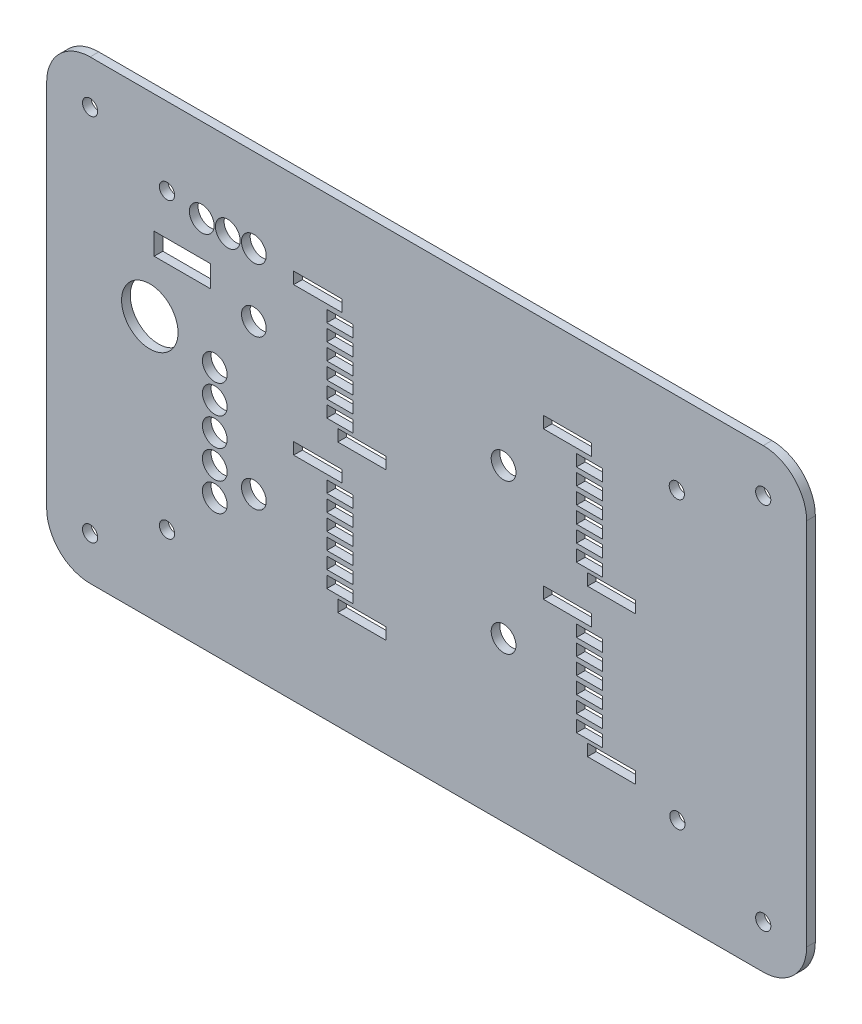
SolidWorks part; units mm, degrees
ref_plane "Face" through (0, 0, 0) normal (0, 0, 1) x (1, 0, 0)
ref_plane "Dessus" through (0, 0, 0) normal (0, 1, 0) x (1, 0, 0)
ref_plane "Droite" through (0, 0, 0) normal (1, 0, 0) x (0, 0, -1)
sketch "Esquisse1" plane through (0, 0, 0) normal (0, 0, 1) x (1, 0, 0)
  line L0 (-21.64, 5.85) -> (-10.56, 5.85)
  line L1 (-31.8, 29.45) -> (-20.72, 29.45)
  line L2 (46.94, -28.15) -> (46.94, -30.85)
  line L3 (46.94, 5.85) -> (46.94, 3.15)
  line L4 (35.86, 5.85) -> (46.94, 5.85)
  line L5 (35.86, 5.85) -> (35.86, 3.15)
  line L6 (-21.64, 3.15) -> (-10.56, 3.15)
  line L7 (-10.56, 5.85) -> (-10.56, 3.15)
  line L8 (-21.64, 5.85) -> (-21.64, 3.15)
  line L9 (35.86, 3.15) -> (46.94, 3.15)
  line L10 (-24.18, 9.35) -> (-18.18, 9.35)
  line L11 (-24.18, 9.35) -> (-24.18, 6.65)
  line L12 (-24.18, 6.65) -> (-18.18, 6.65)
  line L13 (-18.18, 9.35) -> (-18.18, 6.65)
  line L14 (-24.18, 13.15) -> (-18.18, 13.15)
  line L15 (-24.18, 13.15) -> (-24.18, 10.45)
  line L16 (-24.18, 10.45) -> (-18.18, 10.45)
  line L17 (-18.18, 13.15) -> (-18.18, 10.45)
  line L18 (-24.18, 16.95) -> (-18.18, 16.95)
  line L19 (-24.18, 16.95) -> (-24.18, 14.25)
  line L20 (-24.18, 14.25) -> (-18.18, 14.25)
  line L21 (-18.18, 16.95) -> (-18.18, 14.25)
  line L22 (-24.18, 20.75) -> (-18.18, 20.75)
  line L23 (-24.18, 20.75) -> (-24.18, 18.05)
  line L24 (-24.18, 18.05) -> (-18.18, 18.05)
  line L25 (-18.18, 20.75) -> (-18.18, 18.05)
  line L26 (-24.18, 24.55) -> (-18.18, 24.55)
  line L27 (-24.18, 24.55) -> (-24.18, 21.85)
  line L28 (-24.18, 21.85) -> (-18.18, 21.85)
  line L29 (-18.18, 24.55) -> (-18.18, 21.85)
  line L30 (-24.18, 28.35) -> (-18.18, 28.35)
  line L31 (-24.18, 28.35) -> (-24.18, 25.65)
  line L32 (-24.18, 25.65) -> (-18.18, 25.65)
  line L33 (-18.18, 28.35) -> (-18.18, 25.65)
  line L34 (-31.8, 32.15) -> (-20.72, 32.15)
  line L35 (33.32, 9.35) -> (39.32, 9.35)
  line L36 (-20.72, 32.15) -> (-20.72, 29.45)
  line L37 (-31.8, 32.15) -> (-31.8, 29.45)
  line L38 (33.32, 9.35) -> (33.32, 6.65)
  line L39 (33.32, 6.65) -> (39.32, 6.65)
  line L40 (39.32, 9.35) -> (39.32, 6.65)
  line L41 (33.32, 13.15) -> (39.32, 13.15)
  line L42 (33.32, 13.15) -> (33.32, 10.45)
  line L43 (33.32, 10.45) -> (39.32, 10.45)
  line L44 (39.32, 13.15) -> (39.32, 10.45)
  line L45 (33.32, 16.95) -> (39.32, 16.95)
  line L46 (33.32, 16.95) -> (33.32, 14.25)
  line L47 (33.32, 14.25) -> (39.32, 14.25)
  line L48 (39.32, 16.95) -> (39.32, 14.25)
  line L49 (33.32, 20.75) -> (39.32, 20.75)
  line L50 (33.32, 20.75) -> (33.32, 18.05)
  line L51 (33.32, 18.05) -> (39.32, 18.05)
  line L52 (39.32, 20.75) -> (39.32, 18.05)
  line L53 (33.32, 24.55) -> (39.32, 24.55)
  line L54 (33.32, 24.55) -> (33.32, 21.85)
  line L55 (33.32, 21.85) -> (39.32, 21.85)
  line L56 (39.32, 24.55) -> (39.32, 21.85)
  line L57 (33.32, 28.35) -> (39.32, 28.35)
  line L58 (33.32, 28.35) -> (33.32, 25.65)
  line L59 (33.32, 25.65) -> (39.32, 25.65)
  line L60 (39.32, 28.35) -> (39.32, 25.65)
  line L61 (35.86, -28.15) -> (46.94, -28.15)
  line L62 (35.86, -28.15) -> (35.86, -30.85)
  line L63 (36.78, 32.15) -> (36.78, 29.45)
  line L64 (25.7, 32.15) -> (36.78, 32.15)
  line L65 (25.7, 32.15) -> (25.7, 29.45)
  line L66 (25.7, 29.45) -> (36.78, 29.45)
  line L67 (-63.93, 24.05) -> (-50.93, 24.05)
  line L68 (-10.56, -28.15) -> (-10.56, -30.85)
  line L69 (-21.64, -28.15) -> (-10.56, -28.15)
  line L70 (-21.64, -28.15) -> (-21.64, -30.85)
  line L71 (-21.64, -30.85) -> (-10.56, -30.85)
  line L72 (35.86, -30.85) -> (46.94, -30.85)
  line L73 (-24.18, -24.65) -> (-18.18, -24.65)
  line L74 (-24.18, -24.65) -> (-24.18, -27.35)
  line L75 (-24.18, -27.35) -> (-18.18, -27.35)
  line L76 (-18.18, -24.65) -> (-18.18, -27.35)
  line L77 (-24.18, -20.85) -> (-18.18, -20.85)
  line L78 (-24.18, -20.85) -> (-24.18, -23.55)
  line L79 (-24.18, -23.55) -> (-18.18, -23.55)
  line L80 (-18.18, -20.85) -> (-18.18, -23.55)
  line L81 (-24.18, -17.05) -> (-18.18, -17.05)
  line L82 (-24.18, -17.05) -> (-24.18, -19.75)
  line L83 (-24.18, -19.75) -> (-18.18, -19.75)
  line L84 (-18.18, -17.05) -> (-18.18, -19.75)
  line L85 (-24.18, -13.25) -> (-18.18, -13.25)
  line L86 (-24.18, -13.25) -> (-24.18, -15.95)
  line L87 (-24.18, -15.95) -> (-18.18, -15.95)
  line L88 (-18.18, -13.25) -> (-18.18, -15.95)
  line L89 (-24.18, -9.45) -> (-18.18, -9.45)
  line L90 (-24.18, -9.45) -> (-24.18, -12.15)
  line L91 (-24.18, -12.15) -> (-18.18, -12.15)
  line L92 (-18.18, -9.45) -> (-18.18, -12.15)
  line L93 (-24.18, -5.65) -> (-18.18, -5.65)
  line L94 (-24.18, -5.65) -> (-24.18, -8.35)
  line L95 (-24.18, -8.35) -> (-18.18, -8.35)
  line L96 (-18.18, -5.65) -> (-18.18, -8.35)
  line L97 (-63.93, 24.05) -> (-63.93, 19.05)
  line L98 (33.32, -24.65) -> (39.32, -24.65)
  line L99 (-63.93, 19.05) -> (-50.93, 19.05)
  line L100 (-20.72, -1.85) -> (-20.72, -4.55)
  line L101 (-31.8, -1.85) -> (-20.72, -1.85)
  line L102 (-31.8, -1.85) -> (-31.8, -4.55)
  line L103 (-31.8, -4.55) -> (-20.72, -4.55)
  line L104 (33.32, -24.65) -> (33.32, -27.35)
  line L105 (33.32, -27.35) -> (39.32, -27.35)
  line L106 (39.32, -24.65) -> (39.32, -27.35)
  line L107 (33.32, -20.85) -> (39.32, -20.85)
  line L108 (33.32, -20.85) -> (33.32, -23.55)
  line L109 (33.32, -23.55) -> (39.32, -23.55)
  line L110 (39.32, -20.85) -> (39.32, -23.55)
  line L111 (33.32, -17.05) -> (39.32, -17.05)
  line L112 (33.32, -17.05) -> (33.32, -19.75)
  line L113 (33.32, -19.75) -> (39.32, -19.75)
  line L114 (39.32, -17.05) -> (39.32, -19.75)
  line L115 (33.32, -13.25) -> (39.32, -13.25)
  line L116 (33.32, -13.25) -> (33.32, -15.95)
  line L117 (33.32, -15.95) -> (39.32, -15.95)
  line L118 (39.32, -13.25) -> (39.32, -15.95)
  line L119 (33.32, -9.45) -> (39.32, -9.45)
  line L120 (33.32, -9.45) -> (33.32, -12.15)
  line L121 (33.32, -12.15) -> (39.32, -12.15)
  line L122 (39.32, -9.45) -> (39.32, -12.15)
  line L123 (33.32, -5.65) -> (39.32, -5.65)
  line L124 (33.32, -5.65) -> (33.32, -8.35)
  line L125 (33.32, -8.35) -> (39.32, -8.35)
  line L126 (39.32, -5.65) -> (39.32, -8.35)
  line L127 (36.78, -1.85) -> (36.78, -4.55)
  line L128 (25.7, -1.85) -> (36.78, -1.85)
  line L129 (25.7, -1.85) -> (25.7, -4.55)
  line L130 (25.7, -4.55) -> (36.78, -4.55)
  line L131 (-50.93, 24.05) -> (-50.93, 19.05)
  line L133 (-78.68, 51.42) -> (76.32, 51.42)
  line L134 (-88.68, 41.42) -> (-88.68, -43.58)
  line L135 (-78.68, -53.58) -> (76.32, -53.58)
  line L136 (86.32, 41.42) -> (86.32, -43.58)
  circle A0 centre (16.53, 17.55) radius 2.85
  circle A1 centre (-40.97, 17.55) radius 2.85
  circle A2 centre (16.53, -16.9299) radius 2.85
  circle A3 centre (-40.97, -16.9299) radius 2.85
  circle A4 centre (-52.97, 32.05) radius 2.85
  circle A5 centre (-46.97, 32.05) radius 2.85
  circle A6 centre (-40.97, 32.05) radius 2.85
  circle A7 centre (-49.97, 3.8401) radius 2.85
  circle A8 centre (-49.97, -2.6599) radius 2.85
  circle A9 centre (-49.97, -9.1599) radius 2.85
  circle A10 centre (-49.97, -15.6599) radius 2.85
  circle A11 centre (-49.97, -22.1599) radius 2.85
  circle A12 centre (-64.93, 6.55) radius 6.5
  circle A13 centre (-60.97, 33.55) radius 1.75
  circle A14 centre (-60.97, -33.98) radius 1.75
  circle A15 centre (56.56, -33.17) radius 1.75
  circle A16 centre (56.42, 32.6) radius 1.75
  arc A17 (86.32, 41.42) -> (76.32, 51.42) centre (76.32, 41.42) ccw
  arc A18 (76.32, -53.58) -> (86.32, -43.58) centre (76.32, -43.58) ccw
  arc A19 (-88.68, -43.58) -> (-78.68, -53.58) centre (-78.68, -43.58) ccw
  arc A20 (-88.68, 41.42) -> (-78.68, 51.42) centre (-78.68, 41.42) cw
  circle A21 centre (76.32, 41.42) radius 1.75
  circle A22 centre (-78.68, 41.42) radius 1.75
  circle A23 centre (-78.68, -43.58) radius 1.75
  circle A24 centre (76.32, -43.58) radius 1.75
  point P0 (0, 0)
  point P1 (-12.29, 4.5)
  point P2 (-17.37, 4.5)
  point P3 (-19.91, 8)
  point P4 (-27.53, 30.8)
  point P5 (-19.91, 11.8)
  point P6 (-19.91, 15.6)
  point P7 (-19.91, 19.4)
  point P8 (-19.91, 23.2)
  point P9 (-19.91, 27)
  point P10 (-22.45, 30.8)
  point P11 (45.21, 4.5)
  point P12 (40.13, 4.5)
  point P13 (37.59, 8)
  point P14 (31.26, 30.8)
  point P15 (37.59, 11.8)
  point P17 (37.59, 15.6)
  point P47 (37.59, 19.4)
  point P49 (37.59, 23.2)
  point P53 (37.59, 27)
  point P54 (35.05, 30.8)
  point P58 (45.21, -29.5)
  point P60 (-15.4147, -29.5)
  point P89 (-19.91, -26)
  point P90 (-27.66, -3.2)
  point P91 (-19.91, -22.2)
  point P92 (-19.91, -18.4)
  point P93 (-19.91, -14.6)
  point P94 (-19.91, -10.8)
  point P95 (-19.91, -7)
  point P96 (-22.66, -3.2)
  point P97 (43.3317, -30.1809)
  point P98 (37.59, -26)
  point P99 (31.26, -3.2)
  point P100 (37.59, -22.2)
  point P102 (37.59, -18.4)
  point P105 (16.53, 17.55)
  point P108 (-18.5047, -29.5)
  point P133 (37.59, -14.6)
  point P135 (37.59, -10.8)
  point P141 (37.59, -7)
  point P146 (43.3317, -30.1809)
  point P177 (35.05, -3.2)
  point P216 (86.32, 51.42)
  point P221 (-88.68, -53.58)
  point P224 (-88.68, 51.42)
  dimension "D14" = 6.5
  dimension "D19" = 5
  dimension "D76" = 15.2099
  dimension "D17" = 13
  dimension "D74" = 5.7
  dimension "D105" = 10
  dimension "D107" = 3.5
  dimension "D109" = 85
  dimension "D113" = 3.5
  dimension "D115" = 1.5
  dimension "D117" = 6
  dimension "D118" = 6
  dimension "D64" = 8.82
  dimension "D77" = 14.4
  dimension "D130" = 17.87
  dimension "D1" = 12.29
  dimension "D3" = 4.5
  dimension "D4" = 2.54
  dimension "D5" = 3.5
  dimension "D6" = 3.8
  dimension "D7" = 3.8
  dimension "D8" = 3.8
  dimension "D9" = 3.8
  dimension "D10" = 3.8
  dimension "D11" = 3.8
  dimension "D13" = 6.5
  dimension "D15" = 6.5
  dimension "D16" = 6.5
  dimension "D18" = 13
  dimension "D20" = 1.73
  dimension "D21" = 4.27
  dimension "D22" = 1.35
  dimension "D23" = 1.73
  dimension "D24" = 6
  dimension "D25" = 1.35
  dimension "D26" = 1.35
  dimension "D27" = 1.35
  dimension "D28" = 1.35
  dimension "D29" = 1.35
  dimension "D30" = 1.35
  dimension "D31" = 1.35
  dimension "D32" = 36.7
  dimension "D33" = 4.27
  dimension "D34" = 5.08
  dimension "D35" = 2.54
  dimension "D36" = 1.73
  dimension "D37" = 6
  dimension "D38" = 3.8
  dimension "D39" = 1.35
  dimension "D40" = 3.8
  dimension "D41" = 3.8
  dimension "D42" = 3.8
  dimension "D43" = 3.8
  dimension "D44" = 3.8
  dimension "D45" = 3.5
  dimension "D46" = 26.3
  dimension "D47" = 1.35
  dimension "D48" = 1.35
  dimension "D49" = 1.35
  dimension "D50" = 1.35
  dimension "D51" = 1.35
  dimension "D52" = 1.35
  dimension "D53" = 1.35
  dimension "D54" = 3.8
  dimension "D55" = 3.8
  dimension "D56" = 3.8
  dimension "D57" = 3.8
  dimension "D58" = 3.8
  dimension "D59" = 3.8
  dimension "D60" = 17.55
  dimension "D61" = 14.5
  dimension "D62" = 10.56
  dimension "D63" = 57.5
  dimension "D65" = 11.08
  dimension "D66" = 13.62
  dimension "D67" = 13.62
  dimension "D68" = 29
  dimension "D69" = 21.7
  dimension "D70" = 8
  dimension "D71" = 1.5
  dimension "D72" = 12.5
  dimension "D73" = 46.75
  dimension "D75" = 26
  dimension "D78" = 2.7
  dimension "D79" = 1.35
  dimension "D80" = 3.5
  dimension "D81" = 1.35
  dimension "D82" = 1.35
  dimension "D83" = 1.35
  dimension "D84" = 1.35
  dimension "D85" = 1.35
  dimension "D86" = 1.35
  dimension "D87" = 1.35
  dimension "D88" = 29
  dimension "D89" = 22.79
  dimension "D90" = 9
  dimension "D91" = 31.79
  dimension "D92" = 1.27
  dimension "D93" = 21.24
  dimension "D94" = 29
  dimension "D95" = 22.79
  dimension "D96" = 7.62
  dimension "D97" = 1.73
  dimension "D98" = 105
  dimension "D99" = 117.39
  dimension "D100" = 175
  dimension "D101" = 117.53
  dimension "D102" = 67.53
  dimension "D103" = 2.54
  dimension "D104" = 65.77
  dimension "D106" = 155
  dimension "D108" = 10
  dimension "D110" = 10
  dimension "D111" = 0.81
  dimension "D112" = 0.95
  dimension "D114" = 8
  dimension "D116" = 51.42
  dimension "D119" = 27.71
  dimension "D120" = 18.52
  dimension "D121" = 7.62
  dimension "D122" = 88.68
  dimension "D123" = 2.7
  dimension "D124" = 2.7
  dimension "D125" = 11.08
  dimension "D126" = 1.73
  dimension "D127" = 2.54
  dimension "D128" = 7.7
  dimension "D129" = 1.25
extrude "Extrusion1" add sketch "Esquisse1" along normal blind 2
